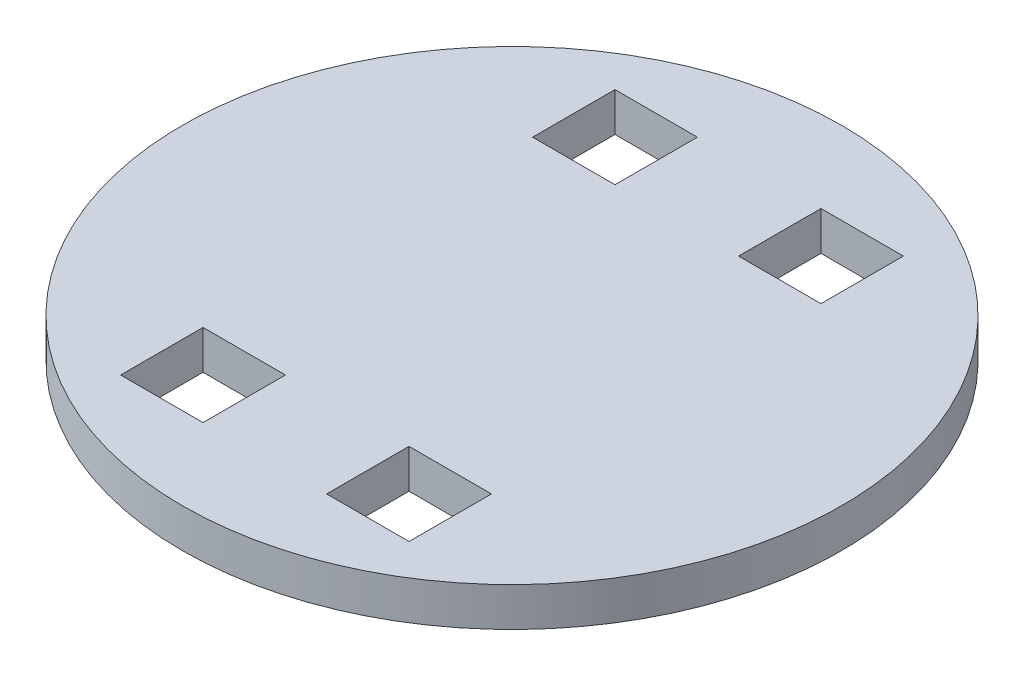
SolidWorks part; units mm, degrees
ref_plane "Front Plane" through (0, 0, 0) normal (0, 0, 1) x (1, 0, 0)
ref_plane "Top Plane" through (0, 0, 0) normal (0, 1, 0) x (1, 0, 0)
ref_plane "Right Plane" through (0, 0, 0) normal (1, 0, 0) x (0, 0, -1)
sketch "Sketch1" plane through (0, 0, 0) normal (0, 1, 0) x (1, 0, 0)
  line L0 (0, 0) -> (0, 25.4) construction
  line L1 (-4.7625, 12.7) -> (-11.1125, 12.7)
  line L2 (4.7625, 12.7) -> (11.1125, 12.7)
  line L3 (4.7625, 12.7) -> (4.7625, 19.05)
  line L4 (4.7625, 19.05) -> (11.1125, 19.05)
  line L5 (11.1125, 12.7) -> (11.1125, 19.05)
  line L6 (-11.1125, 12.7) -> (-11.1125, 19.05)
  line L7 (-4.7625, 19.05) -> (-11.1125, 19.05)
  line L8 (-4.7625, 12.7) -> (-4.7625, 19.05)
  line L9 (0, 0) -> (4.7625, 0) construction
  line L10 (-4.7625, -12.7) -> (-4.7625, -19.05)
  line L11 (-4.7625, -19.05) -> (-11.1125, -19.05)
  line L12 (-11.1125, -12.7) -> (-11.1125, -19.05)
  line L13 (11.1125, -12.7) -> (11.1125, -19.05)
  line L14 (4.7625, -19.05) -> (11.1125, -19.05)
  line L15 (4.7625, -12.7) -> (4.7625, -19.05)
  line L16 (4.7625, -12.7) -> (11.1125, -12.7)
  line L17 (-4.7625, -12.7) -> (-11.1125, -12.7)
  circle A0 centre (0, 0) radius 25.4
  dimension "D1" = 12.7
  dimension "D2" = 50.8
  dimension "D3" = 6.35
  dimension "D4" = 6.35
  dimension "D5" = 4.7625
extrude "Boss-Extrude1" add sketch "Sketch1" along normal blind 2.9972
